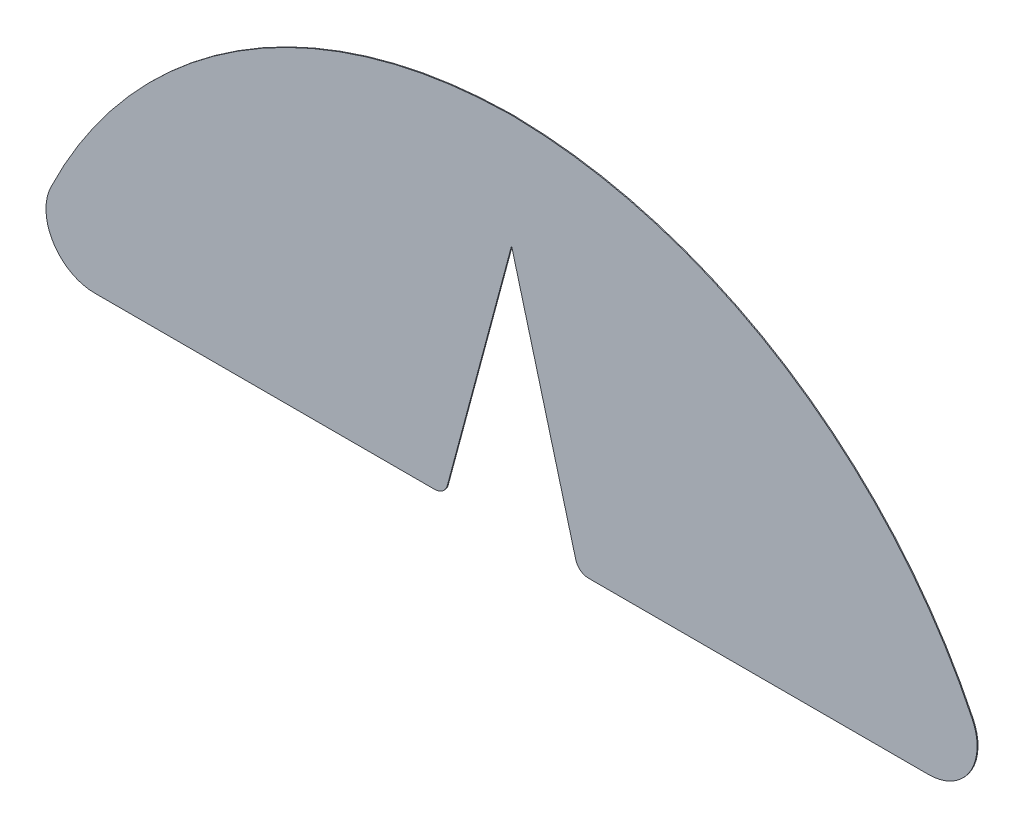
SolidWorks part; units mm, degrees
ref_plane "Plan1" through (0, 0, 0) normal (0, 0, 1) x (1, 0, 0)
ref_plane "Plan2" through (0, 0, 0) normal (0, 1, 0) x (1, 0, 0)
ref_plane "Plan3" through (0, 0, 0) normal (1, 0, 0) x (0, 0, -1)
sketch "Esquisse1" plane through (0, 0, 0) normal (0, 0, 1) x (1, 0, 0)
  line L3 (1, 1.0039) -> (1, -20.8581)
  line L4 (1, -20.8581) -> (-14.5181, -78.7725)
  line L5 (-17.4159, -80.9961) -> (-94.3072, -80.9961)
  arc A3 (-14.5181, -78.7725) -> (-17.4159, -80.9961) centre (-17.4159, -77.9961) cw
  arc A4 (-104.2281, -65.2446) -> (-94.3072, -80.9961) centre (-94.3072, -69.9961) ccw
  arc A5 (1, 1.0039) -> (-104.2281, -65.2446) centre (0.9556, -115.6211) ccw
extrude "Extrusion1" add sketch "Esquisse1" along normal blind 0.2
mirror "Symétrie1" about plane through (0, 0, 0) normal (1, 0, 0) of "Extrusion1"
